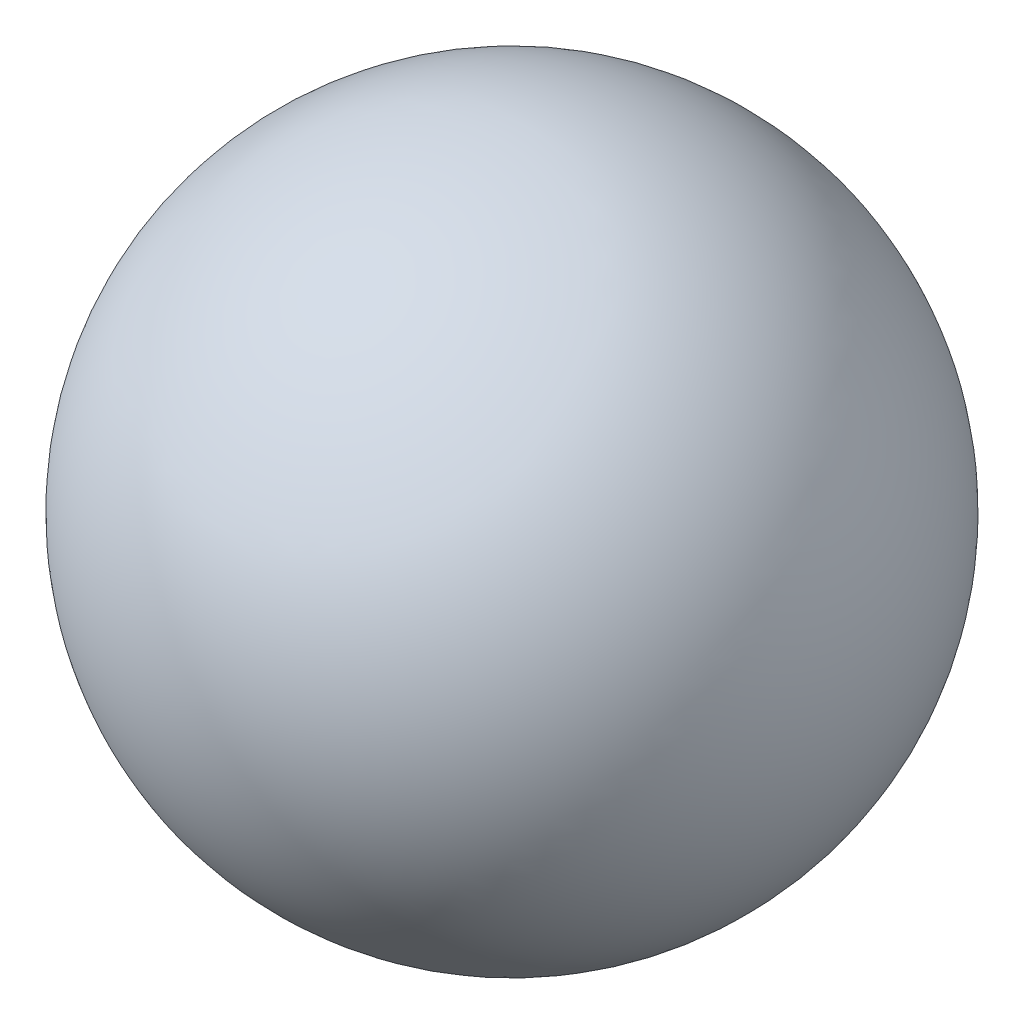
SolidWorks part; units mm, degrees
ref_plane "Front Plane" through (0, 0, 0) normal (0, 0, 1) x (1, 0, 0)
ref_plane "Top Plane" through (0, 0, 0) normal (0, 1, 0) x (1, 0, 0)
ref_plane "Right Plane" through (0, 0, 0) normal (1, 0, 0) x (0, 0, -1)
sketch "Sketch1" plane through (0, 0, 0) normal (1, 0, 0) x (0, 0, -1)
  line L0 (-1.5, 0) -> (1.5, 0) construction
  line L1 (1.5, 0) -> (-1.5, 0)
  arc A0 (-1.5, 0) -> (1.5, 0) centre (0, 0) cw
  dimension "D1" = 3
  dimension "D2" = 1.5
revolve "Revolve1" add sketch "Sketch1" angle 360 about L0
